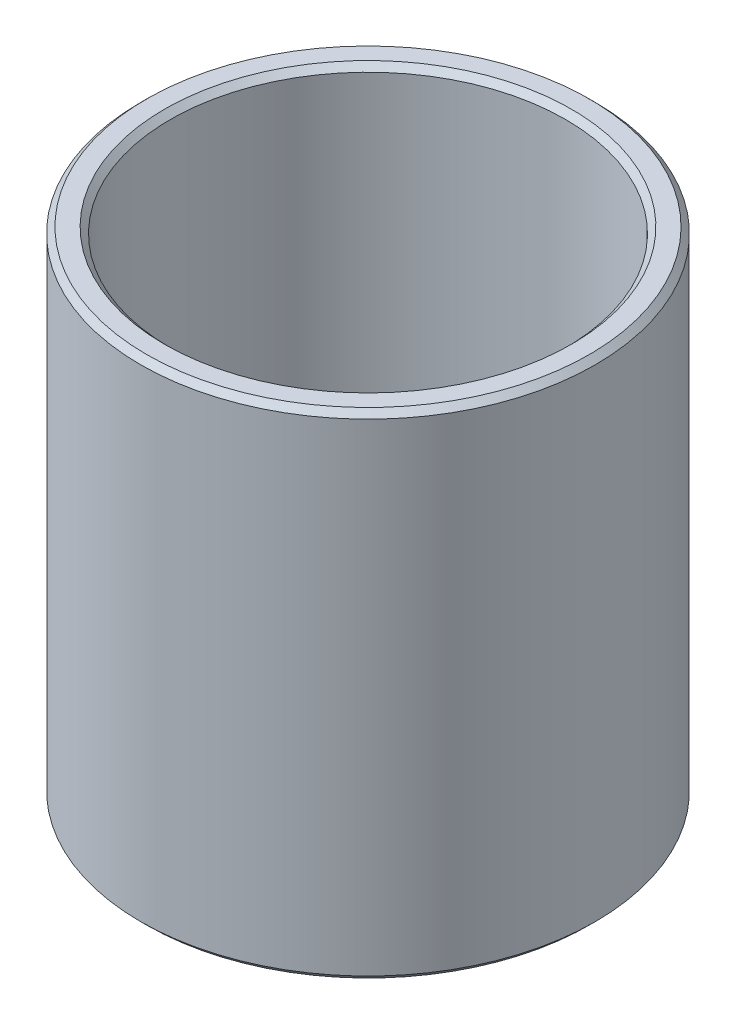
SolidWorks part; units mm, degrees
ref_plane "Piano frontale" through (0, 0, 0) normal (0, 0, 1) x (1, 0, 0)
ref_plane "Piano superiore" through (0, 0, 0) normal (0, 1, 0) x (1, 0, 0)
ref_plane "Piano destro" through (0, 0, 0) normal (1, 0, 0) x (0, 0, -1)
sketch "Schizzo1" plane through (0, 0, 0) normal (0, 1, 0) x (1, 0, 0)
  circle A0 centre (0, 0) radius 11.5
  circle A1 centre (0, 0) radius 10
  dimension "D1" = 23
  dimension "D2" = 20
extrude "Estrusione-Estrusione1" add sketch "Schizzo1" along normal blind 25
chamfer "Smusso1" distance 0.3 angle 45 4 edges at (0, 0, 10) (0, 0, 11.5) (0, 25, 11.5) (0, 25, 10)
